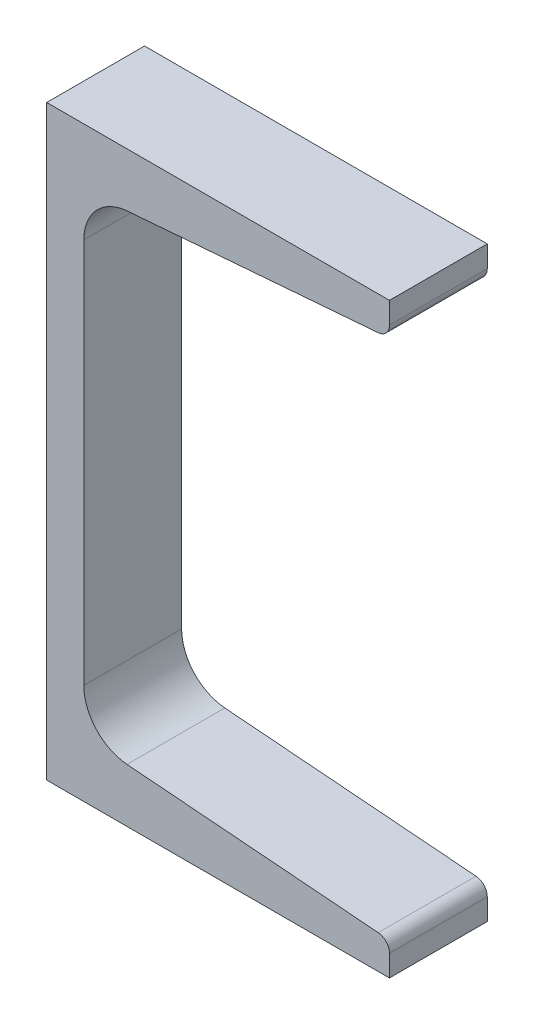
SolidWorks part; units mm, degrees
ref_plane "Plane1" through (0, 0, 0) normal (0, 0, 1) x (1, 0, 0)
ref_plane "Plane2" through (0, 0, 0) normal (0, 1, 0) x (-1, 0, 0)
ref_plane "Plane3" through (0, 0, 0) normal (1, 0, 0) x (0, 0, -1)
sketch "Sketch1" plane through (0, 0, 0) normal (0, 0, 1) x (1, 0, 0)
  line L0 (89.0016, 152.4) -> (0, 152.4)
  line L1 (89.0016, 0) -> (0, 0)
  line L2 (0, 152.4) -> (0, 0)
  line L3 (7.8492, 0) -> (-7.8492, 0) construction
  line L4 (0, -15.6984) -> (0, 15.6984) construction
  line L5 (0, 12.065) -> (59.5008, 12.065) construction
  line L6 (89.0016, 152.4) -> (89.0016, 143.895)
  line L7 (89.0016, 0) -> (89.0016, 8.505)
  line L8 (44.5008, -12.7) -> (44.5008, 165.1) construction
  line L12 (9.6266, 126.2895) -> (9.6266, 26.1105)
  line L17 (20.8464, 138.4427) -> (89.0016, 143.895)
  line L18 (20.8464, 13.9573) -> (89.0016, 8.505)
  arc A9 (9.6266, 26.1105) -> (20.8464, 13.9573) centre (21.8186, 26.1105) ccw
  arc A10 (9.6266, 126.2895) -> (20.8464, 138.4427) centre (21.8186, 126.2895) cw
  point P10 (44.5008, 12.065)
  dimension "RI" = 12.192
  dimension "D2" = 94.574
  dimension "D1" = 44.5008
  dimension "Depth" = 152.4
  dimension "BF" = 89.0016
  dimension "TW" = 9.6266
  dimension "TF" = 12.065
extrude "BaseMchannel" add sketch "Sketch1" along normal mid plane 25.4
fillet "ToeFillet" radius 3.175 2 edges at (89.0016, 8.505, 0) (89.0016, 143.895, 0)
equation "\"D2@Sketch1\" = 94.5739 * (1 + (\"Depth@Sketch1\" > 300)) + 92.86 * (\"Depth@Sketch1\" > 300) * -1"
equation "\"D1@Sketch1\" = (\"BF@Sketch1\" / 2)  *  (1 + (\"Depth@Sketch1\" > 300)) + ((\"BF@Sketch1\" - \"TW@Sketch1\")  / 2) * (\"Depth@Sketch1\" > 300) * -1"
